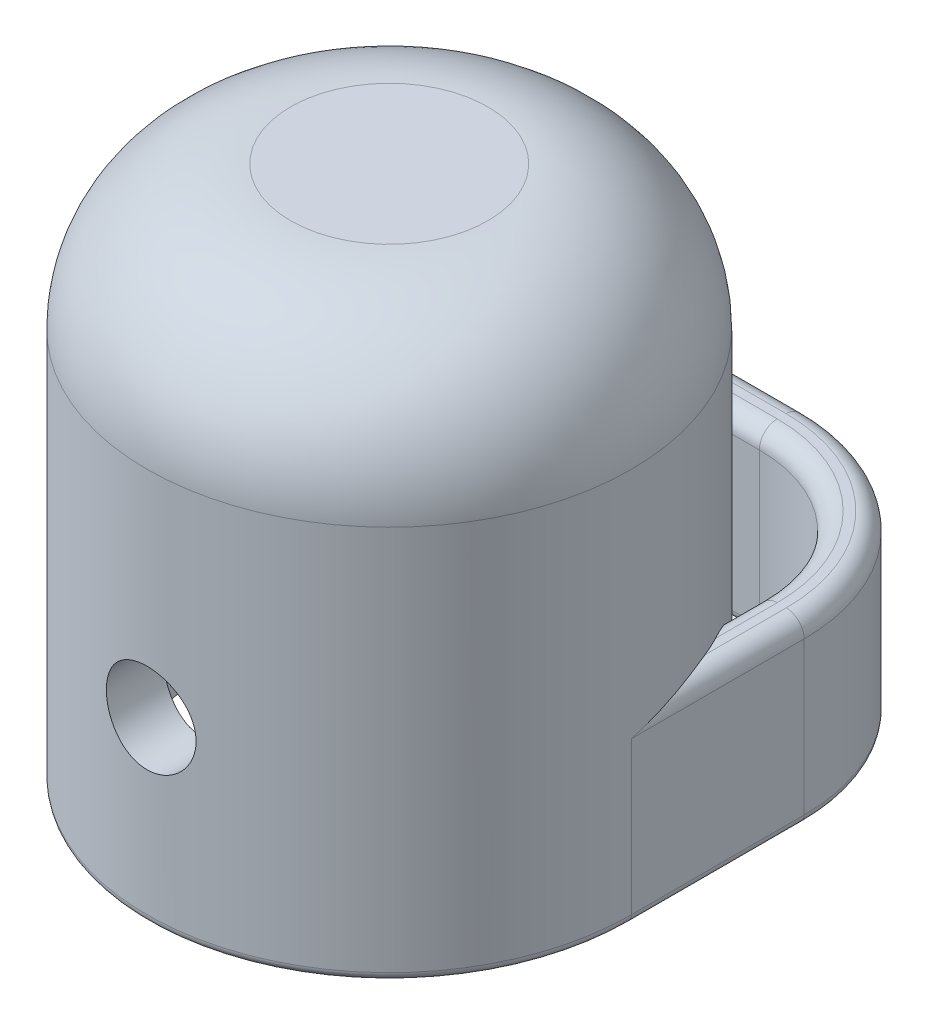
SolidWorks part; units mm, degrees
ref_plane "Front Plane" through (0, 0, 0) normal (0, 0, 1) x (1, 0, 0)
ref_plane "Top Plane" through (0, 0, 0) normal (0, 1, 0) x (1, 0, 0)
ref_plane "Right Plane" through (0, 0, 0) normal (1, 0, 0) x (0, 0, -1)
sketch "Sketch1" plane through (0, 0, 0) normal (0, 1, 0) x (1, 0, 0)
  circle A0 centre (0, 0) radius 8.5725
  dimension "D1" = 17.145
extrude "Boss-Extrude1" add sketch "Sketch1" along normal blind 19.05
sketch "Sketch2" plane through (0, 0, 0) normal (0, -1, 0) x (1, 0, 0)
  circle A0 centre (0, 0) radius 6.604
  dimension "D1" = 13.208
extrude "Cut-Extrude1" cut sketch "Sketch2" against normal blind 12.7
fillet "Fillet1" radius 5.08 1 edges at (0, 19.05, 8.5725)
sketch "Sketch3" plane through (0, 0, 0) normal (0, -1, 0) x (1, 0, 0)
  line L0 (-8.5725, 0) -> (-8.5725, -12.7)
  line L1 (-8.5725, -12.7) -> (8.5725, -12.7)
  line L2 (8.5725, -12.7) -> (8.5725, 0)
  circle A0 centre (0, 0) radius 8.5725 construction
  dimension "D1" = 12.7
extrude "Extrude-Thin2" add sketch "Sketch3" against normal blind 6.35 thin
fillet "Fillet2" radius 0.635 10 edges at (-6.985, 6.35, -5.5411) (-5.5205, 6.35, -9.648) (0, 6.35, -11.1125) (6.985, 6.35, -5.5411) (-8.5725, 6.35, -3.0562) (-6.6431, 6.35, -10.7706) (0, 6.35, -12.7) (8.5725, 6.35, -3.0562) (5.5205, 6.35, -9.648) (6.6431, 6.35, -10.7706)
fillet "Fillet3" radius 0.3175 12 edges at (-6.985, 0, -5.5411) (-5.5205, 0, -9.648) (6.985, 0, -5.5411) (5.5205, 0, -9.648) (-6.6431, 0, -10.7706) (-8.5725, 0, -3.0562) (0, 0, 8.5725) (8.5725, 0, -3.0562) (6.6431, 0, -10.7706) (0, 0, -8.5725) (0, 0, -11.1125) (0, 0, -12.7)
hole_wizard "1/8 (0.125) Diameter Hole1" positions "3DSketch1" profile "Sketch4" hole size "1/8" standard "ANSI Inch"
sketch3d "3DSketch1"
  line L0 (0, 0, 0) -> (0, 6.35, 0) construction
  point P0 (0, 6.35, 8.5725)
  dimension "D1" = 6.35
sketch "Sketch4" plane through (0, 6.35, 8.5725) normal (1, 0, 0) x (0, -1, 0)
  line L0 (0, 0) -> (0, 1.9685)
  line L1 (0, 1.9685) -> (1.5875, 1.9685)
  line L2 (1.5875, 1.9685) -> (1.5875, 0)
  line L5 (1.5875, 0) -> (0, 0)
  line L11 (0, -6.35) -> (0, 107.95) construction
  dimension "Thru Hole Dia." = 3.175
  dimension "Thru Hole Depth" = 1.9685
